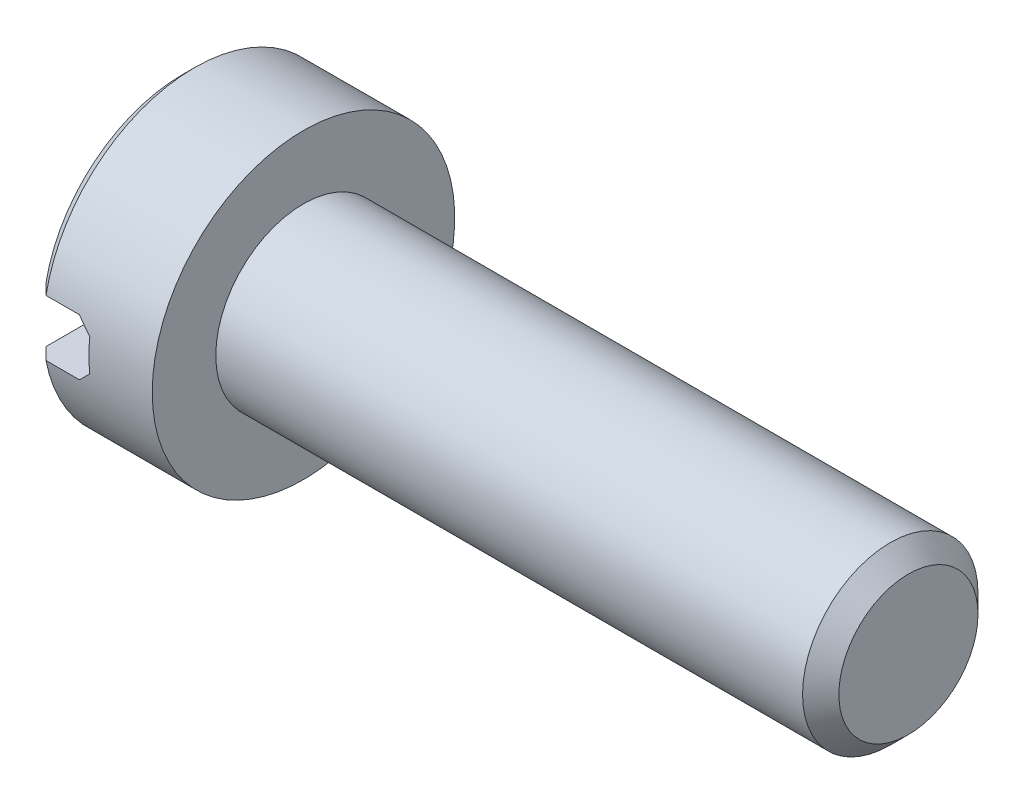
SolidWorks part; units mm, degrees
ref_plane "Face" through (0, 0, 0) normal (0, 0, 1) x (1, 0, 0)
ref_plane "Dessus" through (0, 0, 0) normal (0, 1, 0) x (1, 0, 0)
ref_plane "Droite" through (0, 0, 0) normal (1, 0, 0) x (0, 0, -1)
sketch "Esquisse1" plane through (0, 0, 0) normal (0, 0, 1) x (1, 0, 0)
  line L0 (0, 0) -> (0, 2.3)
  line L1 (0.2, 2.5) -> (2, 2.5)
  line L2 (2, 2.5) -> (2, 0)
  line L5 (0, 0) -> (7.6423, 0) construction
  line L7 (0, 2.3) -> (0.2, 2.5)
  line L8 (0, 0) -> (2, 0)
  point P1 (0, 2.5)
  dimension "D1" = 2.5
  dimension "D3" = 2
revolve "Révolution1" add sketch "Esquisse1" angle 360 about L5
sketch "Esquisse2" plane through (0, 0, 0) normal (0, 0, 1) x (1, 0, 0)
  line L0 (0, 2.3) -> (0, -2.3) construction
  line L1 (0, 0.4655) -> (0.7534, 0.4655)
  line L2 (0, 0.4655) -> (0, -0.4655)
  line L3 (0, -0.4655) -> (0.7534, -0.4655)
  line L4 (0.9534, 0.2655) -> (0.9534, -0.2655)
  line L5 (0.7534, 0.4655) -> (0.9534, 0.2655)
  line L6 (0.7534, -0.4655) -> (0.9534, -0.2655)
  point P1 (0.9534, -0.4655)
  point P3 (0.9534, 0.4655)
extrude "Enlèv. mat.-Extru.1" cut sketch "Esquisse2" against normal mid plane 10
sketch "Esquisse3" plane through (2, 0, 0) normal (1, 0, 0) x (0, 0, -1)
  circle A0 centre (0, 0) radius 1.45
extrude "Extrusion1" add sketch "Esquisse3" along normal blind 10
chamfer "Chanfrein1" distance 0.3 angle 45 1 edges at (12, 0, -1.45)
